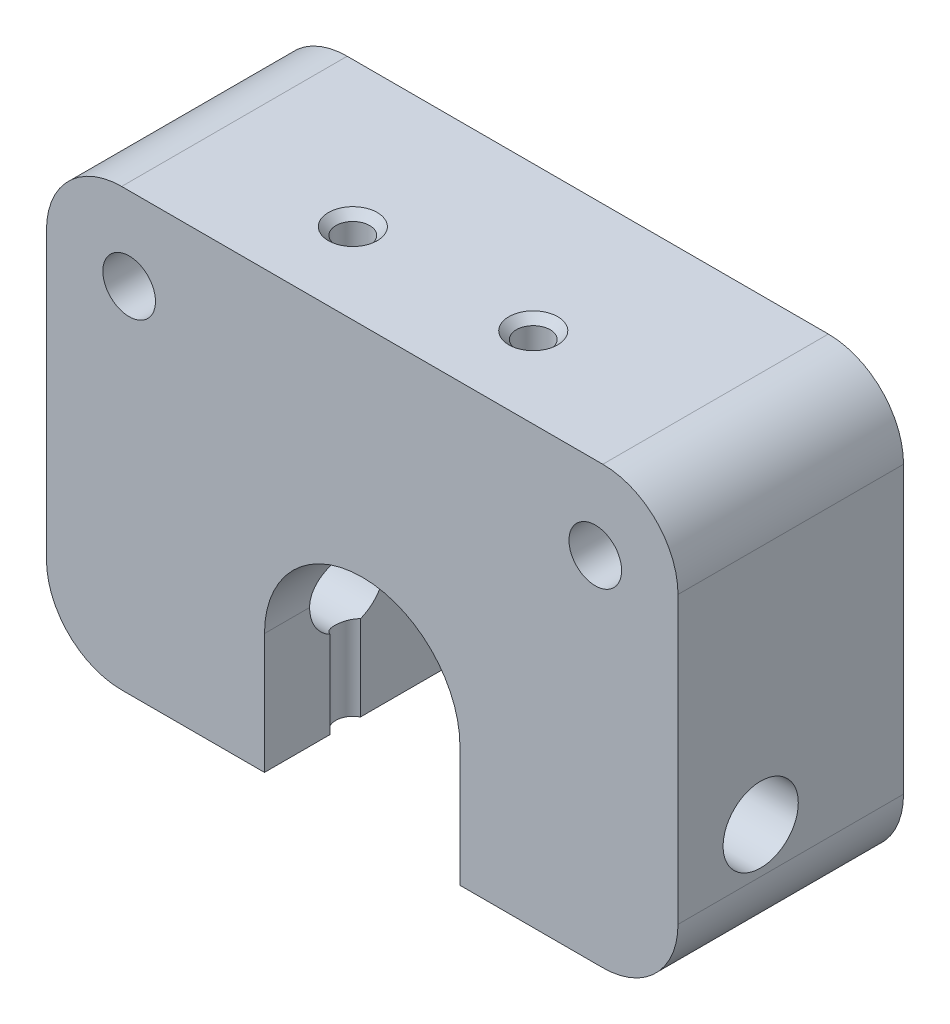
SolidWorks part; units mm, degrees
ref_plane "Front Plane" through (0, 0, 0) normal (0, 0, 1) x (1, 0, 0)
ref_plane "Top Plane" through (0, 0, 0) normal (0, 1, 0) x (1, 0, 0)
ref_plane "Right Plane" through (0, 0, 0) normal (1, 0, 0) x (0, 0, -1)
sketch "Sketch1" plane through (0, 0, 0) normal (0, 0, 1) x (1, 0, 0)
  line L1 (21, -14.5) -> (-21, -14.5)
  line L2 (21, -14.5) -> (21, 14.5)
  line L3 (21, 14.5) -> (-21, 14.5)
  line L4 (-21, -14.5) -> (-21, 14.5)
  line L5 (21, -14.5) -> (-21, 14.5) construction
  line L6 (21, 14.5) -> (-21, -14.5) construction
  point P0 (0, 0)
  dimension "D1" = 42
  dimension "D2" = 29
extrude "Boss-Extrude1" add sketch "Sketch1" along normal blind 15
fillet "Fillet2" radius 5 4 edges at (-21, -14.5, 7.5) (21, -14.5, 7.5) (21, 14.5, 7.5) (-21, 14.5, 7.5)
sketch "Sketch2" plane through (0, 0, 15) normal (0, 0, 1) x (1, 0, 0)
  line L0 (-21, 9) -> (21, 9) construction
  line L1 (-21, 9.5) -> (-21, -9.5) construction
  line L2 (21, -9.5) -> (21, 9.5) construction
  line L3 (16, 14.5) -> (-16, 14.5) construction
  circle A0 centre (-15.5, 9) radius 1.75
  circle A1 centre (15.5, 9) radius 1.75
  dimension "D1" = 3.5
  dimension "D2" = 3.5
  dimension "D3" = 5.5
  dimension "D4" = 5.5
  dimension "D5" = 5.5
extrude "Cut-Extrude1" cut sketch "Sketch2" against normal through all
sketch "Sketch3" plane through (0, 0, 15) normal (0, 0, 1) x (1, 0, 0)
  line L0 (-6.5, -6.5) -> (-6.5, -14.5)
  line L1 (-16, -14.5) -> (16, -14.5) construction
  line L2 (-6.5, -14.5) -> (6.5, -14.5)
  line L3 (6.5, -14.5) -> (6.5, -6.5)
  line L4 (0, -14.5) -> (0, 0) construction
  arc A0 (6.5, -6.5) -> (-6.5, -6.5) centre (0, -6.5) ccw
  dimension "D1" = 13
  dimension "D2" = 8
extrude "Cut-Extrude2" cut sketch "Sketch3" against normal through all
sketch "Sketch4" plane through (0, 14.5, 0) normal (0, 1, 0) x (-1, 0, 0)
  line L0 (6, 9.625) -> (-6, 9.625) construction
  line L4 (0, 15) -> (0, 0) construction
  line L5 (-16, 15) -> (16, 15) construction
  line L6 (-16, 0) -> (16, 0) construction
  circle A0 centre (6, 9.625) radius 1.125
  circle A1 centre (-6, 9.625) radius 1.125
  point P10 (0, 9.625)
  dimension "D1" = 2.25
  dimension "D2" = 2.25
  dimension "D3" = 9.625
  dimension "D4" = 12
extrude "Cut-Extrude3" cut sketch "Sketch4" against normal through all
chamfer "Chamfer1" distance 0.5 1 edges at (-6, 14.5, 10.75)
chamfer "Chamfer2" distance 0.5 1 edges at (6, 14.5, 10.75)
sketch "Sketch5" plane through (21, 0, 0) normal (1, 0, 0) x (0, 0, -1)
  line L0 (0, -9.5) -> (0, 9.5) construction
  line L2 (-15, 14.5) -> (0, 14.5) construction
  circle A0 centre (-9.5, -6.5) radius 2.5
  dimension "D1" = 5
  dimension "D2" = 9.5
  dimension "D3" = 21
extrude "Cut-Extrude4" cut sketch "Sketch5" against normal through all
sketch "Sketch6" plane through (0, 0, 0) normal (0, 0, -1) x (1, 0, 0)
  line L0 (-13.75, 6.5) -> (-13.75, 14.5)
  line L1 (-16, 14.5) -> (-6.5, 14.5) construction
  line L2 (-13.75, 14.5) -> (13.75, 14.5)
  line L3 (6.5, 14.5) -> (16, 14.5) construction
  line L4 (13.75, 14.5) -> (13.75, 6.5)
  line L5 (0, 6.5) -> (0, 0) construction
  arc A0 (-13.75, 6.5) -> (13.75, 6.5) centre (0, 6.5) ccw
  dimension "D1" = 27.5
  dimension "D2" = 8
extrude "Cut-Extrude5" cut sketch "Sketch6" against normal blind 3
